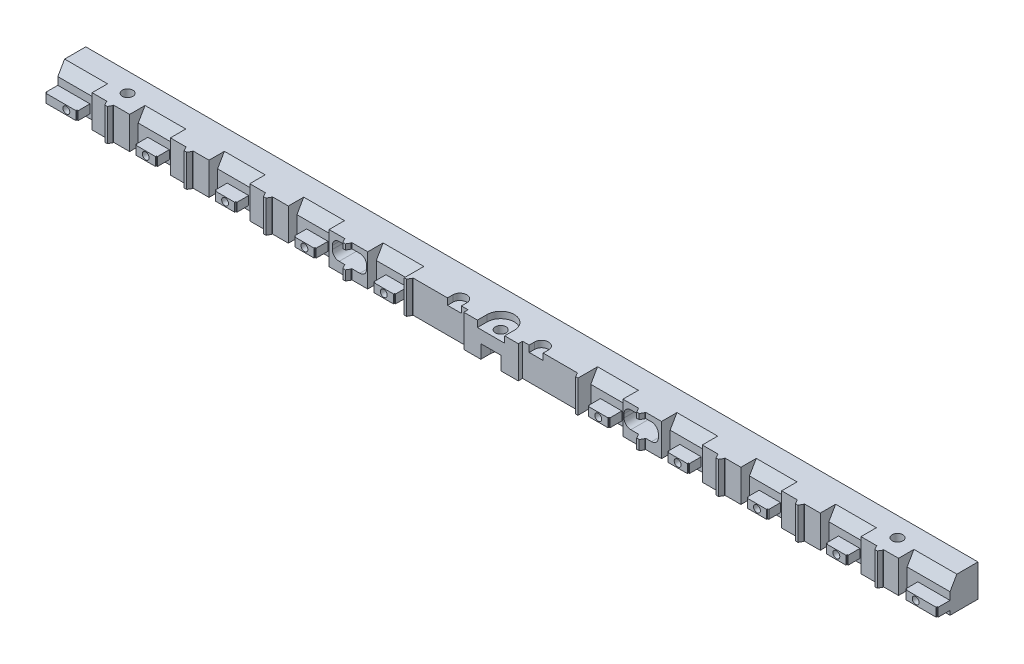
SolidWorks part; units mm, degrees
ref_plane "Front" through (0, 0, 0) normal (0, 0, 1) x (1, 0, 0)
ref_plane "Top" through (0, 0, 0) normal (0, 1, 0) x (1, 0, 0)
ref_plane "Right" through (0, 0, 0) normal (1, 0, 0) x (0, 0, -1)
sketch "Sketch1" plane through (0, 0, 0) normal (0, 1, 0) x (1, 0, 0)
  line L0 (0, 0) -> (0, 8.525) construction
  line L1 (-208, 8.525) -> (208, 8.525)
  line L2 (-208, 8.525) -> (-208, -8.525)
  line L3 (-208, -8.525) -> (208, -8.525)
  line L4 (208, 8.525) -> (208, -8.525)
  line L5 (0, 0) -> (208, 0) construction
  dimension "D1" = 416
  dimension "D2" = 17.05
extrude "Extrude1" add sketch "Sketch1" along normal blind 13.54
sketch "Sketch2" plane through (0, 13.54, 0) normal (0, 1, 0) x (1, 0, 0)
  circle A0 centre (0, -6.025) radius 2.413
  dimension "D1" = 4.826
  dimension "D2" = 6.025
extrude "Extrude2" cut sketch "Sketch2" against normal up to next
sketch "Sketch3" plane through (0, 0, 8.525) normal (0, 0, 1) x (1, 0, 0)
  line L1 (-166, 5.03) -> (-156, 5.03)
  line L2 (-166, 5.03) -> (-166, 0)
  line L3 (-166, 0) -> (-156, 0)
  line L4 (-156, 5.03) -> (-156, 0)
  line L6 (-208, 13.54) -> (-208, 0) construction
  line L7 (-208, 0) -> (208, 0) construction
  dimension "D1" = 42
  dimension "D2" = 10
  dimension "D3" = 5.03
extrude "Extrude3" add sketch "Sketch3" along normal blind 2
pattern_linear "LPattern1" count 4 spacing 37 along (1, 0, 0) of "Extrude3"
sketch "Sketch4" plane through (0, 0, 8.525) normal (0, 0, 1) x (1, 0, 0)
  line L1 (-208, 5.03) -> (-193, 5.03)
  line L2 (-208, 5.03) -> (-208, 0)
  line L3 (-208, 0) -> (-193, 0)
  line L4 (-193, 5.03) -> (-193, 0)
  line L5 (-208, 0) -> (-166, 0) construction
  line L6 (-156, 5.03) -> (-166, 5.03) construction
  line L7 (-208, 13.54) -> (-208, 0) construction
  dimension "D1" = 15
extrude "Extrude4" add sketch "Sketch4" along normal blind 2
sketch "Sketch8" plane through (0, 0, 0) normal (0, -1, 0) x (1, 0, 0)
  line L0 (208, 8.525) -> (208, -8.525) construction
  line L1 (-208, -8.525) -> (208, -8.525)
  line L2 (-208, -8.525) -> (-208, -2.525)
  line L3 (-208, -2.525) -> (208, -2.525)
  line L4 (208, -8.525) -> (208, -2.525)
  dimension "D1" = 6
extrude "Extrude8" add sketch "Sketch8" along normal blind 1.5
mirror "Mirror1" about plane through (0, 0, 0) normal (1, 0, 0) of "Extrude3", "LPattern1", "Extrude4"
hole_wizard "Ø3.2 (3.2) Diameter Hole1" positions "3DSketch1" profile "Sketch7" hole size "Ø3.2" standard "Ansi Metric"
sketch3d "3DSketch1"
  line L0 (208, 13.54, -8.525) -> (208, -1.5, -8.525) construction
  line L1 (208, 0, -8.525) -> (-208, 0, -8.525) construction
  point P0 (198, 2.515, -8.525)
  dimension "D1" = 10
  dimension "D2" = 2.515
sketch "Sketch7" plane through (198, 2.515, -8.525) normal (1, 0, 0) x (0, 1, 0)
  line L0 (0, 0) -> (0, 19.05)
  line L1 (0, 19.05) -> (1.6, 19.05)
  line L2 (1.6, 19.05) -> (1.6, 0.1)
  line L3 (1.6, 0.1) -> (1.7, 0)
  line L5 (1.7, 0) -> (0, 0)
  line L6 (-1.6, 0.1) -> (-1.7, 0) construction
  line L11 (0, -6.35) -> (0, 107.95) construction
  dimension "Thru Hole Dia." = 3.2
  dimension "Thru Hole Depth" = 19.05
  dimension "Near C'Sink Dia." = 3.4
  dimension "Near C'Sink Angle" = 90
pattern_linear "LPattern2" count 5 spacing 37 along (-1, 0, 0) of "Ø3.2 (3.2) Diameter Hole1"
mirror "Mirror2" about plane through (0, 0, 0) normal (1, 0, 0) of "Ø3.2 (3.2) Diameter Hole1", "LPattern2"
sketch "Sketch5" plane through (0, 0, 10.525) normal (0, 0, 1) x (1, 0, 0)
  line L8 (-207.5, 4.53) -> (-207.5, 0.5)
  line L9 (-207.5, 0.5) -> (-193.5, 0.5)
  line L10 (-193.5, 0.5) -> (-193.5, 4.53)
  line L11 (-193.5, 4.53) -> (-207.5, 4.53)
  line L12 (-207.5, 4.53) -> (-207.5, 0.5)
  line L13 (-207.5, 0.5) -> (-193.5, 0.5)
  line L14 (-193.5, 0.5) -> (-193.5, 4.53)
  line L15 (-193.5, 4.53) -> (-207.5, 4.53)
  line L20 (-165.5, 4.53) -> (-165.5, 0.5)
  line L21 (-165.5, 0.5) -> (-156.5, 0.5)
  line L22 (-156.5, 0.5) -> (-156.5, 4.53)
  line L23 (-156.5, 4.53) -> (-165.5, 4.53)
  line L24 (-165.5, 4.53) -> (-165.5, 0.5)
  line L25 (-165.5, 0.5) -> (-156.5, 0.5)
  line L26 (-156.5, 0.5) -> (-156.5, 4.53)
  line L27 (-156.5, 4.53) -> (-165.5, 4.53)
  line L32 (-128.5, 4.53) -> (-128.5, 0.5)
  line L33 (-128.5, 0.5) -> (-119.5, 0.5)
  line L34 (-119.5, 0.5) -> (-119.5, 4.53)
  line L35 (-119.5, 4.53) -> (-128.5, 4.53)
  line L36 (-128.5, 4.53) -> (-128.5, 0.5)
  line L37 (-128.5, 0.5) -> (-119.5, 0.5)
  line L38 (-119.5, 0.5) -> (-119.5, 4.53)
  line L39 (-119.5, 4.53) -> (-128.5, 4.53)
  line L44 (-91.5, 4.53) -> (-91.5, 0.5)
  line L45 (-91.5, 0.5) -> (-82.5, 0.5)
  line L46 (-82.5, 0.5) -> (-82.5, 4.53)
  line L47 (-82.5, 4.53) -> (-91.5, 4.53)
  line L48 (-91.5, 4.53) -> (-91.5, 0.5)
  line L49 (-91.5, 0.5) -> (-82.5, 0.5)
  line L50 (-82.5, 0.5) -> (-82.5, 4.53)
  line L51 (-82.5, 4.53) -> (-91.5, 4.53)
  line L56 (-54.5, 4.53) -> (-54.5, 0.5)
  line L57 (-54.5, 0.5) -> (-45.5, 0.5)
  line L58 (-45.5, 0.5) -> (-45.5, 4.53)
  line L59 (-45.5, 4.53) -> (-54.5, 4.53)
  line L60 (-54.5, 4.53) -> (-54.5, 0.5)
  line L61 (-54.5, 0.5) -> (-45.5, 0.5)
  line L62 (-45.5, 0.5) -> (-45.5, 4.53)
  line L63 (-45.5, 4.53) -> (-54.5, 4.53)
  line L68 (54.5, 0.5) -> (54.5, 4.53)
  line L69 (54.5, 4.53) -> (45.5, 4.53)
  line L70 (45.5, 4.53) -> (45.5, 0.5)
  line L71 (45.5, 0.5) -> (54.5, 0.5)
  line L72 (54.5, 0.5) -> (54.5, 4.53)
  line L73 (54.5, 4.53) -> (45.5, 4.53)
  line L74 (45.5, 4.53) -> (45.5, 0.5)
  line L75 (45.5, 0.5) -> (54.5, 0.5)
  line L80 (91.5, 0.5) -> (91.5, 4.53)
  line L81 (91.5, 4.53) -> (82.5, 4.53)
  line L82 (82.5, 4.53) -> (82.5, 0.5)
  line L83 (82.5, 0.5) -> (91.5, 0.5)
  line L84 (91.5, 0.5) -> (91.5, 4.53)
  line L85 (91.5, 4.53) -> (82.5, 4.53)
  line L86 (82.5, 4.53) -> (82.5, 0.5)
  line L87 (82.5, 0.5) -> (91.5, 0.5)
  line L92 (128.5, 0.5) -> (128.5, 4.53)
  line L93 (128.5, 4.53) -> (119.5, 4.53)
  line L94 (119.5, 4.53) -> (119.5, 0.5)
  line L95 (119.5, 0.5) -> (128.5, 0.5)
  line L96 (128.5, 0.5) -> (128.5, 4.53)
  line L97 (128.5, 4.53) -> (119.5, 4.53)
  line L98 (119.5, 4.53) -> (119.5, 0.5)
  line L99 (119.5, 0.5) -> (128.5, 0.5)
  line L104 (165.5, 0.5) -> (165.5, 4.53)
  line L105 (165.5, 4.53) -> (156.5, 4.53)
  line L106 (156.5, 4.53) -> (156.5, 0.5)
  line L107 (156.5, 0.5) -> (165.5, 0.5)
  line L108 (165.5, 0.5) -> (165.5, 4.53)
  line L109 (165.5, 4.53) -> (156.5, 4.53)
  line L110 (156.5, 4.53) -> (156.5, 0.5)
  line L111 (156.5, 0.5) -> (165.5, 0.5)
  line L116 (207.5, 0.5) -> (207.5, 4.53)
  line L117 (207.5, 4.53) -> (193.5, 4.53)
  line L118 (193.5, 4.53) -> (193.5, 0.5)
  line L119 (193.5, 0.5) -> (207.5, 0.5)
  line L120 (207.5, 0.5) -> (207.5, 4.53)
  line L121 (207.5, 4.53) -> (193.5, 4.53)
  line L122 (193.5, 4.53) -> (193.5, 0.5)
  line L123 (193.5, 0.5) -> (207.5, 0.5)
  line L124 (55, 0) -> (55, 5.03)
  line L125 (55, 5.03) -> (45, 5.03)
  line L126 (45, 5.03) -> (45, 0)
  line L127 (45, 0) -> (55, 0)
  line L128 (55, 0) -> (55, 5.03)
  line L129 (55, 5.03) -> (45, 5.03)
  line L130 (45, 5.03) -> (45, 0)
  line L131 (45, 0) -> (55, 0)
  line L132 (-55, 5.03) -> (-55, 0)
  line L133 (-55, 0) -> (-45, 0)
  line L134 (-45, 0) -> (-45, 5.03)
  line L135 (-45, 5.03) -> (-55, 5.03)
  line L136 (-55, 5.03) -> (-55, 0)
  line L137 (-55, 0) -> (-45, 0)
  line L138 (-45, 0) -> (-45, 5.03)
  line L139 (-45, 5.03) -> (-55, 5.03)
  line L140 (-92, 5.03) -> (-92, 0)
  line L141 (-92, 0) -> (-82, 0)
  line L142 (-82, 0) -> (-82, 5.03)
  line L143 (-82, 5.03) -> (-92, 5.03)
  line L144 (-92, 5.03) -> (-92, 0)
  line L145 (-92, 0) -> (-82, 0)
  line L146 (-82, 0) -> (-82, 5.03)
  line L147 (-82, 5.03) -> (-92, 5.03)
  line L148 (-129, 5.03) -> (-129, 0)
  line L149 (-129, 0) -> (-119, 0)
  line L150 (-119, 0) -> (-119, 5.03)
  line L151 (-119, 5.03) -> (-129, 5.03)
  line L152 (-129, 5.03) -> (-129, 0)
  line L153 (-129, 0) -> (-119, 0)
  line L154 (-119, 0) -> (-119, 5.03)
  line L155 (-119, 5.03) -> (-129, 5.03)
  line L156 (-166, 5.03) -> (-166, 0)
  line L157 (-166, 0) -> (-156, 0)
  line L158 (-156, 0) -> (-156, 5.03)
  line L159 (-156, 5.03) -> (-166, 5.03)
  line L160 (-166, 5.03) -> (-166, 0)
  line L161 (-166, 0) -> (-156, 0)
  line L162 (-156, 0) -> (-156, 5.03)
  line L163 (-156, 5.03) -> (-166, 5.03)
  line L164 (-208, 5.03) -> (-208, 0)
  line L165 (-208, 0) -> (-193, 0)
  line L166 (-193, 0) -> (-193, 5.03)
  line L167 (-193, 5.03) -> (-208, 5.03)
  line L168 (-208, 5.03) -> (-208, 0)
  line L169 (-208, 0) -> (-193, 0)
  line L170 (-193, 0) -> (-193, 5.03)
  line L171 (-193, 5.03) -> (-208, 5.03)
  line L172 (92, 0) -> (92, 5.03)
  line L173 (92, 5.03) -> (82, 5.03)
  line L174 (82, 5.03) -> (82, 0)
  line L175 (82, 0) -> (92, 0)
  line L176 (92, 0) -> (92, 5.03)
  line L177 (92, 5.03) -> (82, 5.03)
  line L178 (82, 5.03) -> (82, 0)
  line L179 (82, 0) -> (92, 0)
  line L180 (129, 0) -> (129, 5.03)
  line L181 (129, 5.03) -> (119, 5.03)
  line L182 (119, 5.03) -> (119, 0)
  line L183 (119, 0) -> (129, 0)
  line L184 (129, 0) -> (129, 5.03)
  line L185 (129, 5.03) -> (119, 5.03)
  line L186 (119, 5.03) -> (119, 0)
  line L187 (119, 0) -> (129, 0)
  line L188 (166, 0) -> (166, 5.03)
  line L189 (166, 5.03) -> (156, 5.03)
  line L190 (156, 5.03) -> (156, 0)
  line L191 (156, 0) -> (166, 0)
  line L192 (166, 0) -> (166, 5.03)
  line L193 (166, 5.03) -> (156, 5.03)
  line L194 (156, 5.03) -> (156, 0)
  line L195 (156, 0) -> (166, 0)
  line L196 (208, 0) -> (208, 5.03)
  line L197 (208, 5.03) -> (193, 5.03)
  line L198 (193, 5.03) -> (193, 0)
  line L199 (193, 0) -> (208, 0)
  line L200 (208, 0) -> (208, 5.03)
  line L201 (208, 5.03) -> (193, 5.03)
  line L202 (193, 5.03) -> (193, 0)
  line L203 (193, 0) -> (208, 0)
  dimension "D1" = 0.5
  dimension "D2" = 0.5
  dimension "D3" = 0.5
  dimension "D4" = 0.5
  dimension "D5" = 0.5
  dimension "D6" = 0.5
  dimension "D7" = 0.5
  dimension "D8" = 0.5
  dimension "D9" = 0.5
  dimension "D10" = 0.5
  dimension "D11" = 0
  dimension "D12" = 0
  dimension "D13" = 0
  dimension "D14" = 0
  dimension "D15" = 0
  dimension "D16" = 0
  dimension "D17" = 0
  dimension "D18" = 0
  dimension "D19" = 0
  dimension "D20" = 0
extrude "Extrude6" cut sketch "Sketch5" against normal blind 0.5
sketch "Sketch9" plane through (0, 0, 8.525) normal (0, 0, 1) x (1, 0, 0)
  line L0 (-208, 13.54) -> (208, 13.54) construction
  line L1 (-181.0875, 13.54) -> (-177.9125, 13.54)
  line L3 (-181.0875, -1.5) -> (-177.9125, -1.5)
  line L4 (-177.9125, 13.54) -> (-177.9125, -1.5)
  line L6 (-179.5, 13.54) -> (-179.5, 2.515) construction
  line L10 (-198, 2.515) -> (-161, 2.515) construction
  line L14 (-181.0875, 13.54) -> (-181.0875, -1.5)
  line L17 (208, -1.5) -> (-208, -1.5) construction
  circle A0 centre (-198, 2.515) radius 1.6 construction
  circle A2 centre (-161, 2.515) radius 1.6 construction
  dimension "D1" = 3.175
extrude "Extrude9" add sketch "Sketch9" along normal up to surface (2 mm away)
sketch "Sketch14" plane through (0, 0, 8.525) normal (0, 0, 1) x (1, 0, 0)
  line L0 (-177.9125, 13.54) -> (208, 13.54) construction
  line L1 (-41.5875, 13.54) -> (-38.4125, 13.54)
  line L2 (-41.5875, 13.54) -> (-41.5875, -1.5)
  line L3 (-41.5875, -1.5) -> (-38.4125, -1.5)
  line L4 (-38.4125, 13.54) -> (-38.4125, -1.5)
  line L6 (-40, 13.54) -> (-40, -1.5) construction
  line L7 (208, -1.5) -> (-208, -1.5) construction
  circle A1 centre (-50, 2.515) radius 1.6 construction
  dimension "D2" = 10
  dimension "D1" = 3.175
extrude "Extrude13" add sketch "Sketch14" along normal up to surface (2 mm away)
pattern_linear "LPattern3" count 4 spacing 37 along (1, 0, 0) of "Extrude9"
chamfer "Chamfer2" distance 1 angle 60 2 edges at (-41.5875, 6.02, 10.525) (-38.4125, 6.02, 10.525)
chamfer "Chamfer1" distance 1 angle 60 8 edges at (-177.9125, 6.02, 10.525) (-181.0875, 6.02, 10.525) (-66.9125, 6.02, 10.525) (-70.0875, 6.02, 10.525) (-103.9125, 6.02, 10.525) (-107.0875, 6.02, 10.525) (-140.9125, 6.02, 10.525) (-144.0875, 6.02, 10.525)
mirror "Mirror4" about plane through (0, 0, 0) normal (1, 0, 0) of "Chamfer1", "Chamfer2", "Extrude9", "LPattern3", "Extrude13"
sketch "Sketch10" plane through (0, 0, 8.525) normal (0, 0, 1) x (1, 0, 0)
  line L1 (-66.9125, 13.54) -> (-41.5875, 13.54) construction
  line L2 (-12.7, 13.54) -> (12.7, 13.54)
  line L3 (-12.7, 13.54) -> (-12.7, 0)
  line L4 (-12.7, 0) -> (12.7, 0)
  line L5 (12.7, 13.54) -> (12.7, 0)
  line L6 (-45, 0) -> (-41.5875, 0) construction
  line L8 (0, 0) -> (0, 13.54) construction
  line L10 (-38.4125, 0) -> (38.4125, 0) construction
  line L11 (-38.4125, 13.54) -> (38.4125, 13.54) construction
  dimension "D1" = 25.4
extrude "Extrude10" add sketch "Sketch10" along normal up to surface (2 mm away)
sketch "Sketch11" plane through (0, 13.54, 0) normal (0, 1, 0) x (1, 0, 0)
  line L0 (-6.35, -6.025) -> (-6.35, -10.525)
  line L1 (12.7, -10.525) -> (-12.7, -10.525) construction
  line L3 (-6.35, -10.525) -> (6.35, -10.525)
  line L4 (0, -10.525) -> (0, 8.525) construction
  line L5 (208, 8.525) -> (-208, 8.525) construction
  line L7 (6.35, -6.025) -> (6.35, -10.525)
  line L8 (15.8, -6.025) -> (15.8, -8.525)
  line L9 (12.7, -8.525) -> (38.4125, -8.525) construction
  line L10 (22.3, -6.025) -> (22.3, -8.525)
  line L11 (-15.8, -6.025) -> (-15.8, -8.525)
  line L12 (-38.4125, -8.525) -> (-12.7, -8.525) construction
  line L13 (-22.3, -6.025) -> (-22.3, -8.525)
  line L14 (15.8, -8.525) -> (22.3, -8.525)
  line L15 (-22.3, -8.525) -> (-15.8, -8.525)
  arc A0 (6.35, -6.025) -> (-6.35, -6.025) centre (0, -6.025) ccw
  circle A1 centre (0, -6.025) radius 2.413 construction
  arc A2 (22.3, -6.025) -> (15.8, -6.025) centre (19.05, -6.025) ccw
  arc A3 (-22.3, -6.025) -> (-15.8, -6.025) centre (-19.05, -6.025) cw
  dimension "D1" = 12.7
  dimension "D2" = 6.5
  dimension "D3" = 38.1
extrude "Extrude11" cut sketch "Sketch11" against normal blind 3
hole_wizard "CBORE for #10 Socket Head Cap Screw1" positions "3DSketch2" profile "Sketch12" counterbore size "#10" standard "Ansi Inch"
sketch3d "3DSketch2"
  circle A0 centre (0, 0, 6.025) radius 2.413 construction
  point P0 (0, 0, 6.025)
  point P5 (0, -2.413, 6.025)
sketch "Sketch12" plane through (0, 0, 6.025) normal (1, 0, 0) x (0, 0, -1)
  line L0 (0, 0) -> (0, 13.54)
  line L1 (0, 13.54) -> (2.4892, 13.54)
  line L3 (2.4892, 13.54) -> (2.4892, 4.826)
  line L4 (2.4892, 4.826) -> (4.7625, 4.826)
  line L5 (4.7625, 4.826) -> (4.7625, 0)
  line L7 (4.7625, 0) -> (0, 0)
  line L11 (0, -6.35) -> (0, 107.95) construction
  dimension "Thru Hole Dia." = 4.9784
  dimension "Thru Hole Depth" = 13.54
  dimension "C'Bore Dia." = 9.525
  dimension "C'Bore Depth" = 4.826
sketch "Sketch13" plane through (0, 0, 0) normal (0, -1, 0) x (1, 0, 0)
  line L0 (4.7625, 6.025) -> (4.7625, 10.525)
  line L1 (1.5593, 10.525) -> (12.7, 10.525) construction
  line L2 (-4.7625, 6.025) -> (-4.7625, 10.525)
  line L3 (-12.7, 10.525) -> (-1.5593, 10.525) construction
  line L4 (-4.7625, 10.525) -> (4.7625, 10.525)
  arc A0 (-1.5593, 10.525) -> (1.5593, 10.525) centre (0, 6.025) ccw construction
  arc A1 (-4.7625, 6.025) -> (4.7625, 6.025) centre (0, 6.025) ccw
extrude "Extrude12" cut sketch "Sketch13" against normal up to surface (4.826 mm away)
sketch "Sketch15" plane through (0, 0, 0) normal (0, -1, 0) x (1, 0, 0)
  line L67 (12.7, 10.525) -> (4.7625, 10.525)
  line L68 (4.7625, 10.525) -> (4.7625, 6.025)
  line L69 (-4.7625, 6.025) -> (-4.7625, 10.525)
  line L70 (-4.7625, 10.525) -> (-12.7, 10.525)
  line L71 (-12.7, 10.525) -> (-12.7, 8.525)
  line L72 (-12.7, 8.525) -> (-38.4125, 8.525)
  line L73 (-38.4125, 8.525) -> (-41.5875, 8.525)
  line L74 (-41.5875, 8.525) -> (-45, 8.525)
  line L75 (-45, 8.525) -> (-45, 10.025)
  line L76 (-45, 10.025) -> (-55, 10.025)
  line L77 (-55, 10.025) -> (-55, 8.525)
  line L78 (-55, 8.525) -> (-66.9125, 8.525)
  line L79 (-66.9125, 8.525) -> (-70.0875, 8.525)
  line L80 (-70.0875, 8.525) -> (-82, 8.525)
  line L81 (-82, 8.525) -> (-82, 10.025)
  line L82 (-82, 10.025) -> (-92, 10.025)
  line L83 (-92, 10.025) -> (-92, 8.525)
  line L84 (-92, 8.525) -> (-103.9125, 8.525)
  line L85 (-103.9125, 8.525) -> (-107.0875, 8.525)
  line L86 (-107.0875, 8.525) -> (-119, 8.525)
  line L87 (-119, 8.525) -> (-119, 10.025)
  line L88 (-119, 10.025) -> (-129, 10.025)
  line L89 (-129, 10.025) -> (-129, 8.525)
  line L90 (-129, 8.525) -> (-140.9125, 8.525)
  line L91 (-140.9125, 8.525) -> (-144.0875, 8.525)
  line L92 (-144.0875, 8.525) -> (-156, 8.525)
  line L93 (-156, 8.525) -> (-156, 10.025)
  line L94 (-156, 10.025) -> (-166, 10.025)
  line L95 (-166, 10.025) -> (-166, 8.525)
  line L96 (-166, 8.525) -> (-177.9125, 8.525)
  line L97 (-177.9125, 8.525) -> (-181.0875, 8.525)
  line L98 (-181.0875, 8.525) -> (-193, 8.525)
  line L99 (-193, 8.525) -> (-193, 10.025)
  line L100 (-193, 10.025) -> (-208, 10.025)
  line L101 (-208, 10.025) -> (-208, -2.525)
  line L102 (-208, -2.525) -> (208, -2.525)
  line L103 (208, -2.525) -> (208, 10.025)
  line L104 (208, 10.025) -> (193, 10.025)
  line L105 (193, 10.025) -> (193, 8.525)
  line L106 (193, 8.525) -> (181.0875, 8.525)
  line L107 (181.0875, 8.525) -> (177.9125, 8.525)
  line L108 (177.9125, 8.525) -> (166, 8.525)
  line L109 (166, 8.525) -> (166, 10.025)
  line L110 (166, 10.025) -> (156, 10.025)
  line L111 (156, 10.025) -> (156, 8.525)
  line L112 (156, 8.525) -> (144.0875, 8.525)
  line L113 (144.0875, 8.525) -> (140.9125, 8.525)
  line L114 (140.9125, 8.525) -> (129, 8.525)
  line L115 (129, 8.525) -> (129, 10.025)
  line L116 (129, 10.025) -> (119, 10.025)
  line L117 (119, 10.025) -> (119, 8.525)
  line L118 (119, 8.525) -> (107.0875, 8.525)
  line L119 (107.0875, 8.525) -> (103.9125, 8.525)
  line L120 (103.9125, 8.525) -> (92, 8.525)
  line L121 (92, 8.525) -> (92, 10.025)
  line L122 (92, 10.025) -> (82, 10.025)
  line L123 (82, 10.025) -> (82, 8.525)
  line L124 (82, 8.525) -> (70.0875, 8.525)
  line L125 (70.0875, 8.525) -> (66.9125, 8.525)
  line L126 (66.9125, 8.525) -> (55, 8.525)
  line L127 (55, 8.525) -> (55, 10.025)
  line L128 (55, 10.025) -> (45, 10.025)
  line L129 (45, 10.025) -> (45, 8.525)
  line L130 (45, 8.525) -> (41.5875, 8.525)
  line L131 (41.5875, 8.525) -> (38.4125, 8.525)
  line L132 (38.4125, 8.525) -> (12.7, 8.525)
  line L133 (12.7, 8.525) -> (12.7, 10.525)
  line L134 (12.7, 10.525) -> (4.7625, 10.525)
  line L135 (4.7625, 10.525) -> (4.7625, 6.025)
  line L136 (-4.7625, 6.025) -> (-4.7625, 10.525)
  line L137 (-4.7625, 10.525) -> (-12.7, 10.525)
  line L138 (-12.7, 10.525) -> (-12.7, 8.525)
  line L139 (-12.7, 8.525) -> (-38.4125, 8.525)
  line L140 (-38.4125, 8.525) -> (-41.5875, 8.525)
  line L141 (-41.5875, 8.525) -> (-45, 8.525)
  line L142 (-45, 8.525) -> (-45, 10.025)
  line L143 (-45, 10.025) -> (-55, 10.025)
  line L144 (-55, 10.025) -> (-55, 8.525)
  line L145 (-55, 8.525) -> (-66.9125, 8.525)
  line L146 (-66.9125, 8.525) -> (-70.0875, 8.525)
  line L147 (-70.0875, 8.525) -> (-82, 8.525)
  line L148 (-82, 8.525) -> (-82, 10.025)
  line L149 (-82, 10.025) -> (-92, 10.025)
  line L150 (-92, 10.025) -> (-92, 8.525)
  line L151 (-92, 8.525) -> (-103.9125, 8.525)
  line L152 (-103.9125, 8.525) -> (-107.0875, 8.525)
  line L153 (-107.0875, 8.525) -> (-119, 8.525)
  line L154 (-119, 8.525) -> (-119, 10.025)
  line L155 (-119, 10.025) -> (-129, 10.025)
  line L156 (-129, 10.025) -> (-129, 8.525)
  line L157 (-129, 8.525) -> (-140.9125, 8.525)
  line L158 (-140.9125, 8.525) -> (-144.0875, 8.525)
  line L159 (-144.0875, 8.525) -> (-156, 8.525)
  line L160 (-156, 8.525) -> (-156, 10.025)
  line L161 (-156, 10.025) -> (-166, 10.025)
  line L162 (-166, 10.025) -> (-166, 8.525)
  line L163 (-166, 8.525) -> (-177.9125, 8.525)
  line L164 (-177.9125, 8.525) -> (-181.0875, 8.525)
  line L165 (-181.0875, 8.525) -> (-193, 8.525)
  line L166 (-193, 8.525) -> (-193, 10.025)
  line L167 (-193, 10.025) -> (-208, 10.025)
  line L168 (-208, 10.025) -> (-208, -2.525)
  line L169 (-208, -2.525) -> (208, -2.525)
  line L170 (208, -2.525) -> (208, 10.025)
  line L171 (208, 10.025) -> (193, 10.025)
  line L172 (193, 10.025) -> (193, 8.525)
  line L173 (193, 8.525) -> (181.0875, 8.525)
  line L174 (181.0875, 8.525) -> (177.9125, 8.525)
  line L175 (177.9125, 8.525) -> (166, 8.525)
  line L176 (166, 8.525) -> (166, 10.025)
  line L177 (166, 10.025) -> (156, 10.025)
  line L178 (156, 10.025) -> (156, 8.525)
  line L179 (156, 8.525) -> (144.0875, 8.525)
  line L180 (144.0875, 8.525) -> (140.9125, 8.525)
  line L181 (140.9125, 8.525) -> (129, 8.525)
  line L182 (129, 8.525) -> (129, 10.025)
  line L183 (129, 10.025) -> (119, 10.025)
  line L184 (119, 10.025) -> (119, 8.525)
  line L185 (119, 8.525) -> (107.0875, 8.525)
  line L186 (107.0875, 8.525) -> (103.9125, 8.525)
  line L187 (103.9125, 8.525) -> (92, 8.525)
  line L188 (92, 8.525) -> (92, 10.025)
  line L189 (92, 10.025) -> (82, 10.025)
  line L190 (82, 10.025) -> (82, 8.525)
  line L191 (82, 8.525) -> (70.0875, 8.525)
  line L192 (70.0875, 8.525) -> (66.9125, 8.525)
  line L193 (66.9125, 8.525) -> (55, 8.525)
  line L194 (55, 8.525) -> (55, 10.025)
  line L195 (55, 10.025) -> (45, 10.025)
  line L196 (45, 10.025) -> (45, 8.525)
  line L197 (45, 8.525) -> (41.5875, 8.525)
  line L198 (41.5875, 8.525) -> (38.4125, 8.525)
  line L199 (38.4125, 8.525) -> (12.7, 8.525)
  line L200 (12.7, 8.525) -> (12.7, 10.525)
  arc A1 (-4.7625, 6.025) -> (4.7625, 6.025) centre (0, 6.025) ccw
  arc A2 (-4.7625, 6.025) -> (4.7625, 6.025) centre (0, 6.025) ccw
  dimension "D1" = 0
extrude "Extrude14" add sketch "Sketch15" along normal up to surface (1.5 mm away)
sketch "Sketch16" plane through (0, 0, 10.525) normal (0, 0, 1) x (1, 0, 0)
  line L4 (-177.9125, 13.54) -> (-144.0875, 13.54) construction
  line L5 (-170.5, 13.54) -> (-151.5, 13.54)
  line L6 (-156, -1.5) -> (-156, 5.03) construction
  line L7 (-156, 0.5) -> (-156, 4.53)
  line L8 (-151.5, -4.5) -> (-151.5, 9.53)
  line L9 (-151.5, 9.53) -> (-170.5, 9.53)
  line L10 (-170.5, 9.53) -> (-170.5, -4.5)
  line L11 (-170.5, -4.5) -> (-151.5, -4.5)
  line L12 (-151.5, -4.5) -> (-151.5, 13.54)
  line L13 (-166, 5.03) -> (-166, -1.5) construction
  line L14 (-170.5, 13.54) -> (-170.5, -4.5)
  line L15 (-170.5, -4.5) -> (-151.5, -4.5)
  line L16 (-156.5, 0.5) -> (-156.5, 4.53)
  line L17 (-156.5, 4.53) -> (-165.5, 4.53)
  line L18 (-165.5, 4.53) -> (-165.5, 0.5)
  line L19 (-165.5, 0.5) -> (-156.5, 0.5)
  line L21 (-156, 4.53) -> (-166, 4.53)
  line L23 (-166, 0.5) -> (-156, 0.5)
  line L24 (-166, 4.53) -> (-166, 0.5)
  dimension "D1" = 5
  dimension "D2" = 0
extrude "Extrude15" cut sketch "Sketch16" against normal blind 6
pattern_linear "LPattern4" count 4 spacing 37 along (1, 0, 0) of "Extrude15"
chamfer "Chamfer4" distance 3.175 angle 60 4 edges at (-161, 13.54, 4.525) (-50, 13.54, 4.525) (-87, 13.54, 4.525) (-124, 13.54, 4.525)
sketch "Sketch18" plane through (0, 0, 10.525) normal (0, 0, 1) x (1, 0, 0)
  line L6 (-193, -1.5) -> (-193, 5.03) construction
  line L7 (-193, 0.5) -> (-193, 4.53)
  line L8 (-188, -1.5) -> (-188, 10.03)
  line L9 (-188, 10.03) -> (-208, 10.03)
  line L10 (-188, -1.5) -> (-188, 13.54)
  line L11 (-208, 13.54) -> (-181.0875, 13.54) construction
  line L12 (-193.5, 4.53) -> (-207.5, 4.53) construction
  line L13 (-193, 4.53) -> (-208, 4.53)
  line L14 (-207.5, 0.5) -> (-193.5, 0.5) construction
  line L15 (-208, 0.5) -> (-193, 0.5)
  line L16 (-208, 5.03) -> (-208, -1.5) construction
  line L17 (-208, 0.5) -> (-208, -1.5)
  line L18 (-208, 13.54) -> (-208, 5.03) construction
  line L19 (-208, 13.54) -> (-208, 4.53)
  line L20 (-208, -1.5) -> (-193, -1.5) construction
  line L21 (-208, -1.5) -> (-188, -1.5)
  line L22 (-208, 13.54) -> (-188, 13.54)
  dimension "D1" = 5
extrude "Extrude16" cut sketch "Sketch18" against normal up to surface (6 mm away)
chamfer "Chamfer5" distance 3.175 angle 60 1 edges at (-198, 13.54, 4.525)
sketch "Sketch20" plane through (0, 0, 8.525) normal (0, 0, 1) x (1, 0, 0)
  line L1 (-72.826, 11.04) -> (-63.174, 11.04)
  line L2 (-76, 7.866) -> (-76, 6.214)
  line L3 (-72.826, 3.04) -> (-63.174, 3.04)
  line L4 (-59.5, -1.5) -> (-59.5, 13.54) construction
  line L5 (-77.5, 13.54) -> (-70.0875, 13.54) construction
  line L7 (-77.5, 13.54) -> (-77.5, -1.5) construction
  line L12 (-60, 6.214) -> (-60, 7.866)
  arc A0 (-72.826, 11.04) -> (-76, 7.866) centre (-72.826, 7.866) ccw
  arc A1 (-60, 7.866) -> (-63.174, 11.04) centre (-63.174, 7.866) ccw
  arc A2 (-60, 6.214) -> (-63.174, 3.04) centre (-63.174, 6.214) cw
  arc A3 (-76, 6.214) -> (-72.826, 3.04) centre (-72.826, 6.214) ccw
  dimension "D3" = 3.174
  dimension "D5" = 3.174
  dimension "D6" = 8
  dimension "D1" = 0.5
  dimension "D2" = 2.5
  dimension "D4" = 1.5
extrude "Extrude17" cut sketch "Sketch20" against normal through all and the other way through all
mirror "Mirror5" about plane through (0, 0, 0) normal (1, 0, 0) of "Extrude17", "Extrude15", "Chamfer4", "LPattern4", "Extrude16", "Chamfer5"
hole_wizard "CBORE for #10 Socket Head Cap Screw2" positions "3DSketch3" profile "Sketch21" counterbore size "#10" standard "Ansi Inch"
sketch3d "3DSketch3"
  line L0 (-208, -1.5, -8.525) -> (208, -1.5, -8.525) construction
  line L1 (208, -1.5, -8.525) -> (208, -1.5, 4.525) construction
  point P0 (179.5, -1.5, 0.475)
  dimension "D1" = 9
  dimension "D2" = 28.5
sketch "Sketch21" plane through (179.5, -1.5, 0.475) normal (1, 0, 0) x (0, 0, -1)
  line L0 (0, 0) -> (0, 15.04)
  line L1 (0, 15.04) -> (2.4892, 15.04)
  line L3 (2.4892, 15.04) -> (2.4892, 4.826)
  line L4 (2.4892, 4.826) -> (4.7625, 4.826)
  line L5 (4.7625, 4.826) -> (4.7625, 0)
  line L7 (4.7625, 0) -> (0, 0)
  line L11 (0, -6.35) -> (0, 107.95) construction
  dimension "Thru Hole Dia." = 4.9784
  dimension "Thru Hole Depth" = 15.04
  dimension "C'Bore Dia." = 9.525
  dimension "C'Bore Depth" = 4.826
mirror "Mirror6" about plane through (0, 0, 0) normal (1, 0, 0) of "CBORE for #10 Socket Head Cap Screw2"
